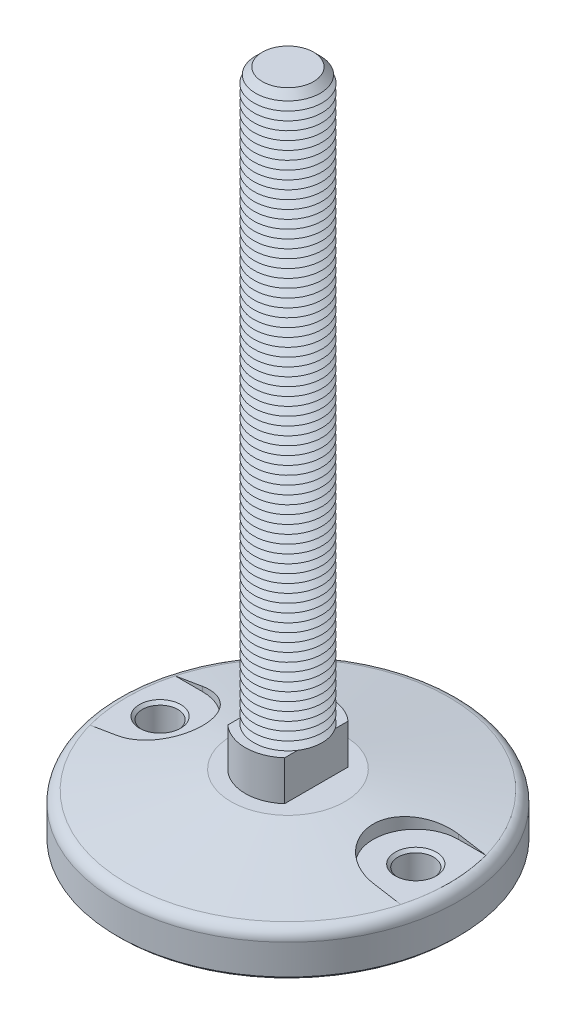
SolidWorks part; units mm, degrees
ref_plane "Front Plane" through (0, 0, 0) normal (0, 0, 1) x (1, 0, 0)
ref_plane "Top Plane" through (0, 0, 0) normal (0, 1, 0) x (1, 0, 0)
ref_plane "Right Plane" through (0, 0, 0) normal (1, 0, 0) x (0, 0, -1)
sketch "Sketch1" plane through (0, 0, 0) normal (1, 0, 0) x (0, 0, -1)
  line L0 (0, 61.3389) -> (0, -58.404) construction
sketch "Sketch2" plane through (0, 0, 0) normal (1, 0, 0) x (0, 0, -1)
  line L0 (0, 0) -> (-20, 0)
  line L1 (-20, 0) -> (-60, -7.0531)
  line L2 (-60, -7.0531) -> (-60, -22)
  line L3 (-60, -22) -> (0, -22)
  line L4 (0, 61.3389) -> (0, -58.404) construction
  line L5 (0, -22) -> (0, 0)
  dimension "D1" = 22
  dimension "D2" = 60
  dimension "D3" = 20
  dimension "D4" = 10
revolve "Revolve1" add sketch "Sketch2" angle 360 about L0
fillet "Fillet1" radius 4 1 edges at (0, -7.0531, 60)
sketch "Sketch3" plane through (0, 0, 0) normal (0, 1, 0) x (1, 0, 0)
  circle A0 centre (0, 0) radius 15
  dimension "D1" = 30
extrude "Boss-Extrude1" add sketch "Sketch3" along normal blind 14
sketch "Sketch4" plane through (0, 14, 0) normal (0, 1, 0) x (1, 0, 0)
  line L0 (-10, 11.1803) -> (-10, -11.1803)
  line L2 (10, -11.1803) -> (10, 11.1803)
  arc A0 (-10, 11.1803) -> (-10, -11.1803) centre (0, 0) ccw
  circle A1 centre (0, 0) radius 15 construction
  arc A2 (10, -11.1803) -> (10, 11.1803) centre (0, 0) ccw
  dimension "D1" = 20
extrude "Cut-Extrude1" cut sketch "Sketch4" against normal blind 14
sketch "Sketch5" plane through (0, 14, 0) normal (0, 1, 0) x (1, 0, 0)
  circle A0 centre (0, 0) radius 12
  dimension "D1" = 24
extrude "Boss-Extrude2" add sketch "Sketch5" along normal blind 200
chamfer "Chamfer1" distance 3 angle 45 1 edges at (0, 214, 12)
sketch "Sketch6" plane through (0, 0, 0) normal (1, 0, 0) x (0, 0, -1)
  line L0 (-12, 14) -> (-9.4019, 15.5)
  line L1 (-9.4019, 15.5) -> (-12, 17)
  line L2 (-12, 211) -> (-12, 14) construction
  line L3 (-12, 17) -> (-12, 14)
  dimension "D1" = 3
revolve "Cut-Revolve1" cut sketch "Sketch6" angle 360 about L0
pattern_linear "LPattern1" count 66 spacing 3 along (0, 1, 0) of "Cut-Revolve1"
sketch "Sketch8" plane through (0, 0, 0) normal (0, 1, 0) x (1, 0, 0)
  line L0 (-45, 15) -> (-54.6743, 15)
  line L1 (-45, -15) -> (-54.6743, -15)
  arc A1 (-54.6743, 15) -> (-54.6743, -15) centre (0, 0) ccw
  circle A2 centre (0, 0) radius 56.6946 construction
  arc A3 (-45, -15) -> (-45, 15) centre (-45, 0) ccw
  point P3 (-45, 0)
  point P11 (0, 0)
  dimension "D1" = 45
  dimension "D2" = 30
extrude "Cut-Extrude4" cut sketch "Sketch8" against normal blind 6.47
sketch "Sketch10" plane through (0, -6.47, 0) normal (0, 1, 0) x (1, 0, 0)
  circle A0 centre (-45, 0) radius 6.25
  dimension "D1" = 12.5
extrude "Cut-Extrude5" cut sketch "Sketch10" against normal up to surface (15.53 mm away)
chamfer "Chamfer2" distance 1 angle 45 2 edges at (-45, -22, -6.25) (-45, -6.47, 6.25)
mirror "Mirror1" about plane through (0, 0, 0) normal (1, 0, 0) of "Chamfer2", "Cut-Extrude5", "Cut-Extrude4"
chamfer "Chamfer3" distance 1 angle 45 1 edges at (0, -22, 60)
